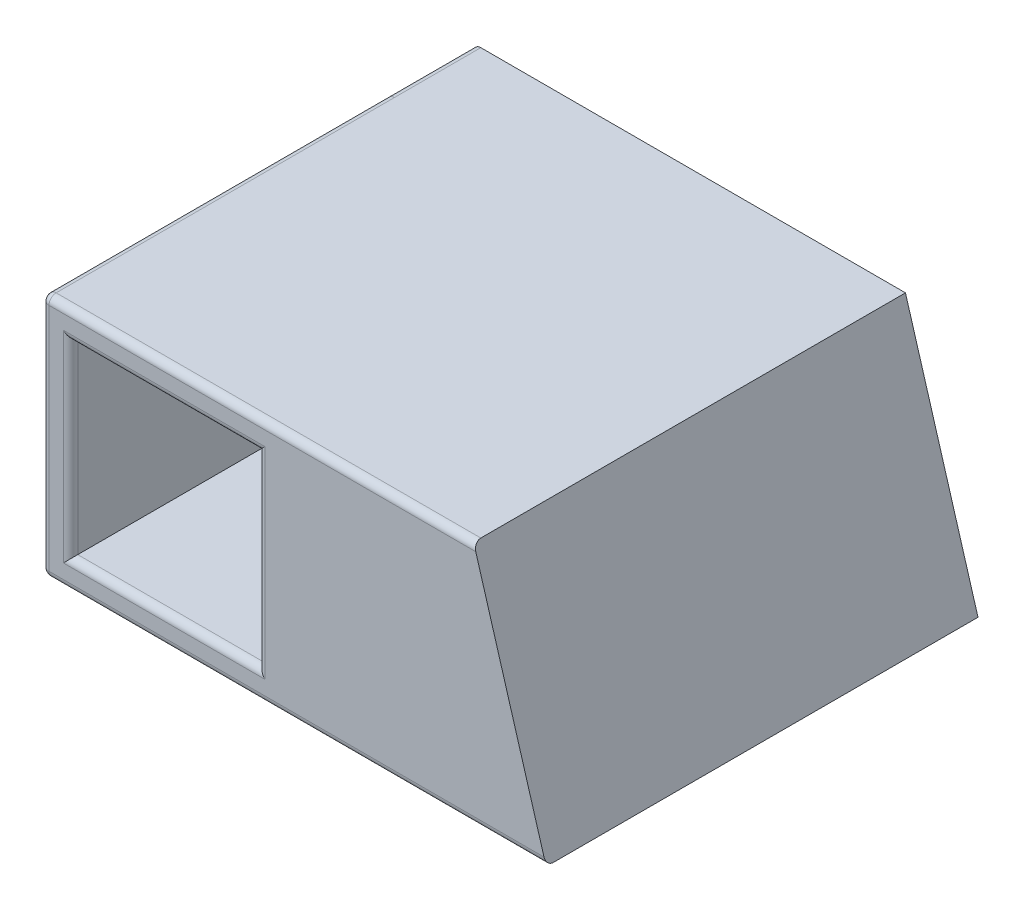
SolidWorks part; units mm, degrees
ref_plane "Front Plane" through (0, 0, 0) normal (0, 0, 1) x (1, 0, 0)
ref_plane "Top Plane" through (0, 0, 0) normal (0, 1, 0) x (1, 0, 0)
ref_plane "Right Plane" through (0, 0, 0) normal (1, 0, 0) x (0, 0, -1)
sketch "Sketch4" plane through (0, 0, 0) normal (0, 0, 1) x (1, 0, 0)
  line L0 (0, 0) -> (0, 4.318)
  line L1 (0, 4.318) -> (7.62, 4.318)
  line L2 (7.62, 4.318) -> (8.8999, 0)
  line L3 (8.8999, 0) -> (0, 0)
  line L5 (0.508, 3.81) -> (3.81, 3.81)
  line L6 (0.508, 3.81) -> (0.508, 0.508)
  line L7 (0.508, 0.508) -> (3.81, 0.508)
  line L8 (3.81, 3.81) -> (3.81, 0.508)
  dimension "D1" = 73.49
  dimension "D2" = 0.508
  dimension "D3" = 0.508
  dimension "D4" = 0.508
extrude "Boss-Extrude1" add sketch "Sketch4" along normal blind 6.35
fillet "Fillet1" radius 0.127 4 edges at (2.159, 0.508, 6.35) (0.508, 2.159, 6.35) (2.159, 3.81, 6.35) (3.81, 2.159, 6.35)
fillet "Fillet2" radius 0.127 4 edges at (0.508, 2.159, 0) (2.159, 0.508, 0) (3.81, 2.159, 0) (2.159, 3.81, 0)
fillet "Fillet3" radius 0.127 8 edges at (4.4499, 0, 0) (4.4499, 0, 6.35) (3.81, 4.318, 0) (3.81, 4.318, 6.35) (0, 2.159, 0) (0, 2.159, 6.35) (0, 0, 3.175) (0, 4.318, 3.175)
sketch "Sketch5" plane through (0, 0, 0) normal (0, 0, -1) x (-1, 0, 0)
  line L0 (-8.8999, 0) -> (-7.62, 4.318)
  line L1 (-7.62, 4.318) -> (0, 4.318)
  line L2 (0, 4.318) -> (0, 0)
  line L3 (0, 0) -> (-8.8999, 0)
extrude "Boss-Extrude2" add sketch "Sketch5" along normal blind 1.27 and the other way blind 0.254
fillet "Fillet4" radius 0.127 2 edges at (0, 0, -0.508) (0, 4.318, -0.508)
